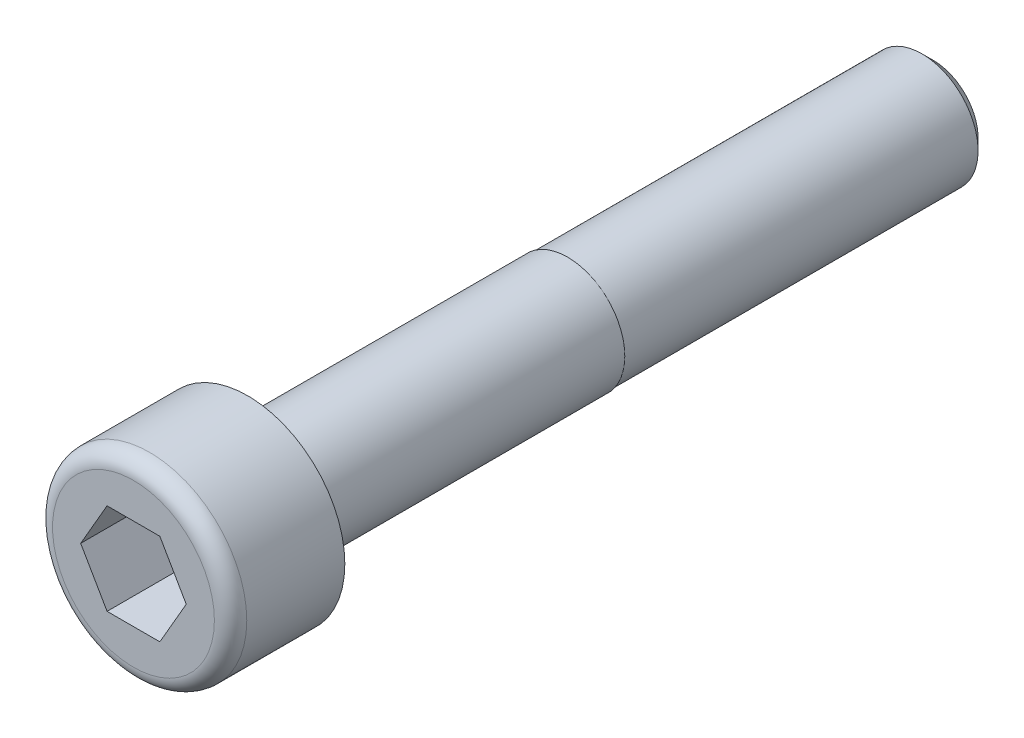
SolidWorks part; units mm, degrees
ref_plane "Plane1" through (0, 0, 0) normal (0, 0, 1) x (1, 0, 0)
ref_plane "Plane2" through (0, 0, 0) normal (0, 1, 0) x (1, 0, 0)
ref_plane "Plane3" through (0, 0, 0) normal (1, 0, 0) x (0, 0, -1)
sketch "Esquisse1" plane through (0, 0, 0) normal (0, 0, 1) x (1, 0, 0)
  circle A0 centre (0, 0) radius 4.25
  dimension "D1" = 8.5
extrude "Base-Extrusion" add sketch "Esquisse1" along normal blind 5
sketch "Esquisse2" plane through (0, 0, 0) normal (0, 0, -1) x (-1, 0, 0)
  circle A0 centre (0, 0) radius 2.5
  circle A1 centre (0, 0) radius 4.25 construction
  dimension "D1" = 5
extrude "Boss.-Extru.1" add sketch "Esquisse2" along normal blind 14
sketch "Esquisse3" plane through (0, 0, 5) normal (0, 0, 1) x (1, 0, 0)
  line L0 (0, 0) -> (0, 4.2257) construction
  line L1 (0, 0) -> (4.4294, 0) construction
  line L2 (2.3094, 0) -> (1.1547, 2)
  line L3 (1.1547, 2) -> (-1.1547, 2)
  line L4 (-1.1547, 2) -> (-2.3094, 0)
  line L5 (-2.3094, 0) -> (-1.1547, -2)
  line L6 (-1.1547, -2) -> (1.1547, -2)
  line L7 (1.1547, -2) -> (2.3094, 0)
  dimension "D1" = 4
  dimension "D3" = 120
extrude "Enlèv. mat.-Extru.1" cut sketch "Esquisse3" against normal blind 5
sketch "Esquisse6" plane through (0, 0, -14) normal (0, 0, -1) x (-1, 0, 0)
  circle A0 centre (0, 0) radius 2.45
  dimension "D1" = 4.9
extrude "Boss.-Extru.3" add sketch "Esquisse6" along normal blind 16
chamfer "Chanfrein3" distance 0.49 angle 45 1 edges at (-2.45, 0, -30)
fillet "Congé1" radius 0.7083 1 edges at (4.25, 0, 5)
equation "\"D1@Esquisse6\" = \"D1@Esquisse2\"-0.1"
equation "\"D1@Chanfrein3\" = \"D1@Esquisse6\"/10"
equation "\"D1@Congé1\" = \"D1@Esquisse1\"/12"
